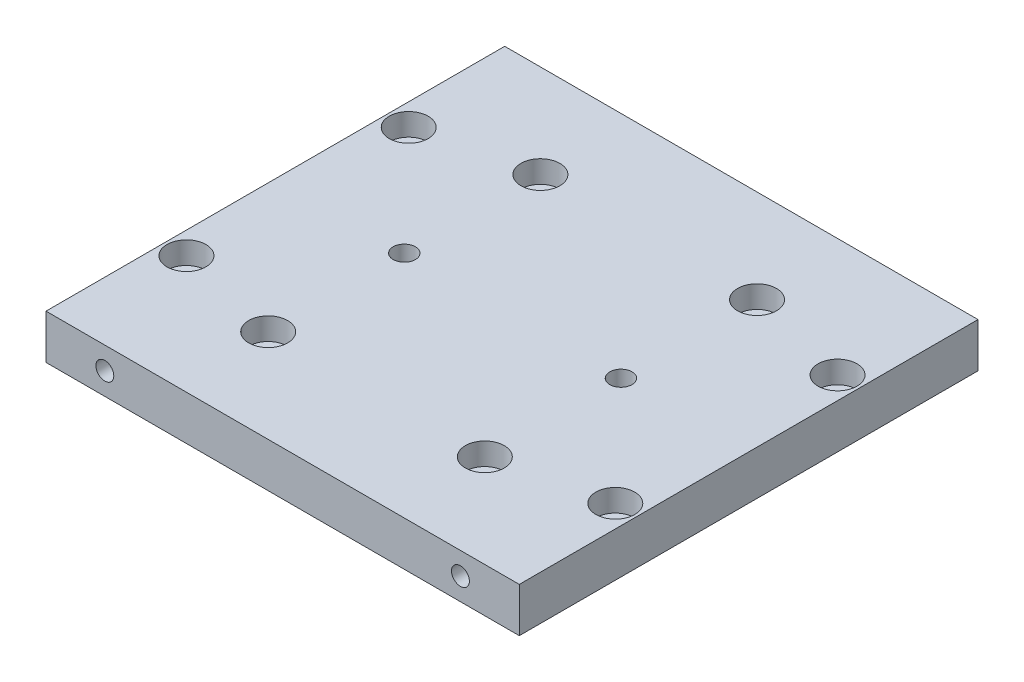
SolidWorks part; units mm, degrees
ref_plane "Front Plane" through (0, 0, 0) normal (0, 0, 1) x (1, 0, 0)
ref_plane "Top Plane" through (0, 0, 0) normal (0, 1, 0) x (1, 0, 0)
ref_plane "Right Plane" through (0, 0, 0) normal (1, 0, 0) x (0, 0, -1)
sketch "Sketch1" plane through (0, 0, 0) normal (0, 1, 0) x (1, 0, 0)
  line L1 (-67.6148, 65.532) -> (67.6148, 65.532)
  line L2 (-67.6148, 65.532) -> (-67.6148, -65.532)
  line L3 (-67.6148, -65.532) -> (67.6148, -65.532)
  line L4 (67.6148, 65.532) -> (67.6148, -65.532)
  line L5 (-67.6148, 65.532) -> (67.6148, -65.532) construction
  line L6 (-67.6148, -65.532) -> (67.6148, 65.532) construction
  point P0 (0, 0)
  dimension "D1" = 131.064
  dimension "D2" = 135.2296
extrude "Boss-Extrude1" add sketch "Sketch1" along normal blind 12.7
hole_wizard "CBORE for 1/4 Socket Head Cap Screw1" positions "Sketch2" profile "Sketch3" counterbore size "1/4" standard "ANSI Inch"
sketch "Sketch2" plane through (0, 12.7, 0) normal (0, 1, 0) x (1, 0, 0)
  point P0 (31.1229, -38.8874)
  point P3 (-30.7769, -38.8874)
  point P6 (-30.7769, 38.8874)
  point P9 (31.1229, 38.8874)
sketch "Sketch3" plane through (31.1229, 12.7, 38.8874) normal (1, 0, 0) x (0, 0, 1)
  line L0 (0, 0) -> (0, 12.7)
  line L1 (0, 12.7) -> (3.3782, 12.7)
  line L3 (3.3782, 12.7) -> (3.3782, 6.35)
  line L4 (3.3782, 6.35) -> (5.5562, 6.35)
  line L5 (5.5562, 6.35) -> (5.5563, 0)
  line L7 (5.5563, 0) -> (0, 0)
  line L11 (0, -6.35) -> (0, 107.95) construction
  dimension "Thru Hole Dia." = 6.7564
  dimension "Thru Hole Depth" = 12.7
  dimension "C'Bore Dia." = 11.1125
  dimension "C'Bore Depth" = 6.35
hole_wizard "1/4 (0.2500) Dowel Hole1" positions "Sketch4" profile "Sketch5" hole size "1/4" standard "ANSI Inch"
sketch "Sketch4" plane through (0, 12.7, 0) normal (0, 1, 0) x (1, 0, 0)
  point P0 (-30.7769, 0)
  point P3 (31.1229, 0)
sketch "Sketch5" plane through (-30.7769, 12.7, 0) normal (1, 0, 0) x (0, 0, 1)
  line L0 (0, 0) -> (0, 12.7)
  line L1 (0, 12.7) -> (3.175, 12.7)
  line L2 (3.175, 12.7) -> (3.175, 0)
  line L5 (3.175, 0) -> (0, 0)
  line L11 (0, -6.35) -> (0, 107.95) construction
  dimension "Thru Hole Dia." = 6.35
  dimension "Thru Hole Depth" = 12.7
hole_wizard "CBORE for 1/4 Socket Head Cap Screw2" positions "Sketch6" profile "Sketch7" counterbore size "1/4" standard "ANSI Inch"
sketch "Sketch6" plane through (0, 12.7, 0) normal (0, 1, 0) x (1, 0, 0)
  point P0 (-61.2648, -31.75)
  point P3 (-61.2648, 31.75)
  point P6 (61.2648, -31.75)
  point P9 (61.2648, 31.75)
sketch "Sketch7" plane through (-61.2648, 12.7, 31.75) normal (1, 0, 0) x (0, 0, 1)
  line L0 (0, 0) -> (0, 12.7)
  line L1 (0, 12.7) -> (3.3782, 12.7)
  line L3 (3.3782, 12.7) -> (3.3782, 6.35)
  line L4 (3.3782, 6.35) -> (5.5562, 6.35)
  line L5 (5.5562, 6.35) -> (5.5562, 0)
  line L7 (5.5562, 0) -> (0, 0)
  line L11 (0, -6.35) -> (0, 107.95) construction
  dimension "Thru Hole Dia." = 6.7564
  dimension "Thru Hole Depth" = 12.7
  dimension "C'Bore Dia." = 11.1125
  dimension "C'Bore Depth" = 6.35
hole_wizard "1/4-20 Tapped Hole1" positions "Sketch8" profile "Sketch9" tap size "1/4-20" standard "ANSI Inch"
sketch "Sketch8" [suppressed] plane through (0, 12.7, 0) normal (0, 1, 0) x (1, 0, 0)
  point P0 (12, -57.032)
  point P3 (-12, -57.032)
sketch "Sketch9" [suppressed] plane through (12, 12.7, 57.032) normal (1, 0, 0) x (0, 0, 1)
  line L0 (0, 0) -> (0, 12.7)
  line L1 (0, 12.7) -> (2.5527, 12.7)
  line L2 (2.5527, 12.7) -> (2.5527, 0)
  line L5 (2.5527, 0) -> (0, 0)
  line L11 (0, -6.35) -> (0, 107.95) construction
  dimension "Thru Tap Drill Dia." = 5.1054
  dimension "Thru Tap Drill Depth" = 12.7
hole_wizard "1/4-20 Tapped Hole2" positions "Sketch10" profile "Sketch11" tap size "1/4-20" standard "ANSI Inch"
sketch "Sketch10" plane through (0, 0, 65.532) normal (0, 0, 1) x (1, 0, 0)
  line L0 (0, 12.7) -> (0, 29.0889) construction
  line L1 (-67.6148, 12.7) -> (67.6148, 12.7) construction
  line L3 (-67.6148, 6.35) -> (-50.8, 6.35) construction
  line L4 (-67.6148, 12.7) -> (-67.6148, 0) construction
  point P0 (-50.8, 6.35)
  point P15 (50.8, 6.35)
  dimension "D1" = 101.6
sketch "Sketch11" plane through (-50.8, 6.35, 65.532) normal (1, 0, 0) x (0, -1, 0)
  line L0 (0, 0) -> (0, 18.0438)
  line L1 (0, 18.0438) -> (2.5527, 16.51)
  line L2 (2.5527, 16.51) -> (2.5527, 0)
  line L5 (2.5527, 0) -> (0, 0)
  line L10 (0, 18.0438) -> (-2.5527, 16.51) construction
  line L11 (0, -6.35) -> (0, 107.95) construction
  dimension "Tap Drill Dia." = 5.1054
  dimension "Tap Drill Depth" = 16.51
  dimension "Drill Angle" = 118
